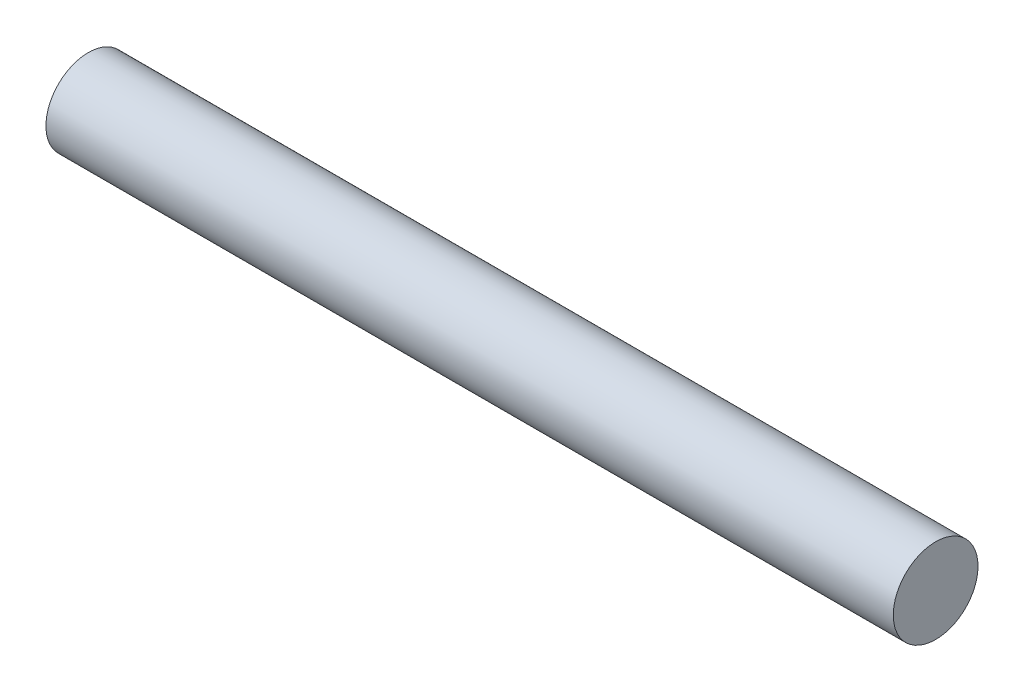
SolidWorks part; units mm, degrees
ref_plane "Front Plane" through (0, 0, 0) normal (0, 0, 1) x (1, 0, 0)
ref_plane "Top Plane" through (0, 0, 0) normal (0, 1, 0) x (1, 0, 0)
ref_plane "Right Plane" through (0, 0, 0) normal (1, 0, 0) x (0, 0, -1)
sketch "Sketch1" plane through (0, 0, 0) normal (1, 0, 0) x (0, 0, -1)
  circle A0 centre (0, 0) radius 2
  dimension "D1" = 4
extrude "Boss-Extrude1" add sketch "Sketch1" along normal mid plane 40
